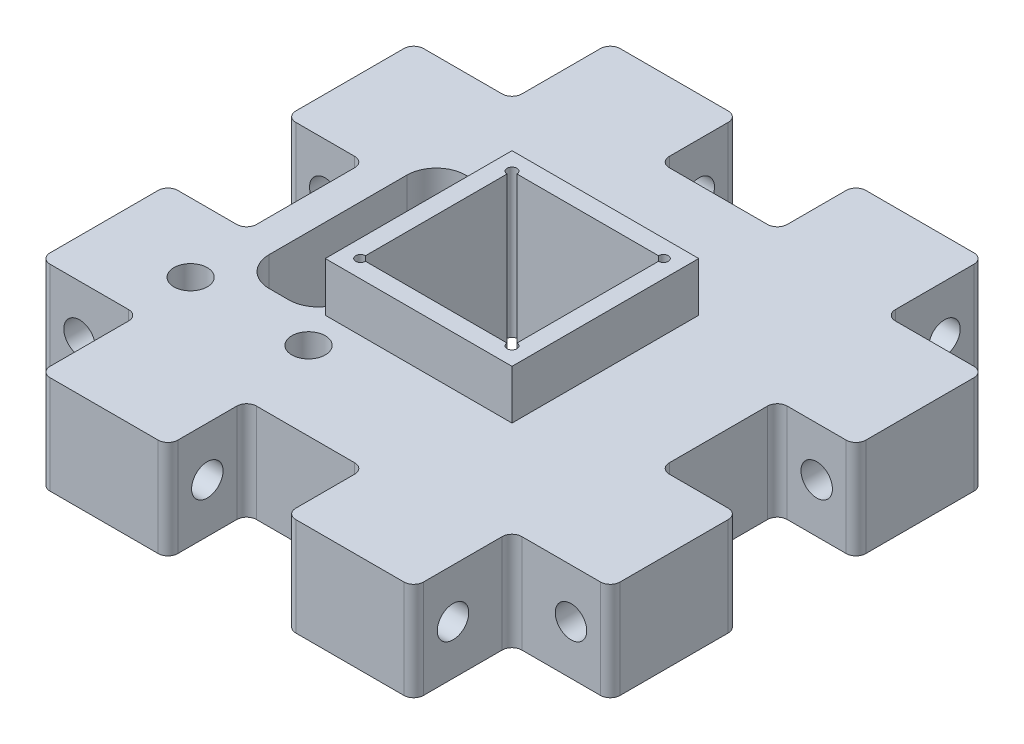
SolidWorks part; units mm, degrees
ref_plane "Front" through (0, 0, 0) normal (0, 0, 1) x (1, 0, 0)
ref_plane "Top" through (0, 0, 0) normal (0, 1, 0) x (1, 0, 0)
ref_plane "Right" through (0, 0, 0) normal (1, 0, 0) x (0, 0, -1)
sketch "草图1" plane through (0, 0, 0) normal (0, 1, 0) x (1, 0, 0)
  line L1 (-29, -29) -> (29, -29)
  line L2 (-29, -29) -> (-29, 29)
  line L3 (-29, 29) -> (29, 29)
  line L4 (29, -29) -> (29, 29)
  line L5 (-29, -29) -> (29, 29) construction
  line L6 (-29, 29) -> (29, -29) construction
  line L7 (-7.7, -7.7) -> (7.7, -7.7)
  line L8 (-7.7, -7.7) -> (-7.7, 7.7)
  line L9 (-7.7, 7.7) -> (7.7, 7.7)
  line L10 (7.7, -7.7) -> (7.7, 7.7)
  line L11 (-7.7, -7.7) -> (7.7, 7.7) construction
  line L12 (-7.7, 7.7) -> (7.7, -7.7) construction
  point P0 (0, 0)
  point P5 (0, 0)
  dimension "D1" = 58
  dimension "D2" = 58
  dimension "D3" = 15.4
  dimension "D4" = 15.4
extrude "凸台-拉伸1" add sketch "草图1" along normal blind 10
sketch "草图2" plane through (0, 10, 0) normal (0, 1, 0) x (1, 0, 0)
  line L0 (29, 6) -> (21, 6)
  line L1 (29, -29) -> (29, 29) construction
  line L2 (21, 6) -> (21, -6)
  line L3 (21, -6) -> (29, -6)
  line L5 (-6, 29) -> (-6, 21)
  line L6 (6, 21) -> (6, 29)
  line L7 (-6, 21) -> (6, 21)
  line L8 (-29, -6) -> (-21, -6)
  line L9 (-21, 6) -> (-29, 6)
  line L10 (-21, -6) -> (-21, 6)
  line L11 (6, -29) -> (6, -21)
  line L12 (-6, -21) -> (-6, -29)
  line L13 (6, -21) -> (-6, -21)
  point P23 (0, 0)
  dimension "D1" = 8
  dimension "D2" = 12
  dimension "D3" = 6
  dimension "D4" = 4
extrude "切除-拉伸1" cut sketch "草图2" against normal up to next contours L5 L7 L6 M14 | L2 L3 L0 M13 | L11 L13 L12 M16 | L8 L10 L9 M15
sketch "草图4" plane through (-29, 0, 0) normal (-1, 0, 0) x (0, 0, 1)
  line L0 (-29, 10) -> (-6, 10) construction
  line L1 (-29, 10) -> (-29, 0) construction
  circle A0 centre (-25, 5) radius 1.6
  dimension "D1" = 3.2
  dimension "D2" = 5
  dimension "D3" = 4
extrude "切除-拉伸2" cut sketch "草图4" against normal up to surface (58 mm away)
sketch "草图5" plane through (0, 0, -29) normal (0, 0, -1) x (-1, 0, 0)
  line L0 (6, 0) -> (29, 0) construction
  line L1 (29, 10) -> (29, 0) construction
  circle A0 centre (25, 5) radius 1.6
  dimension "D1" = 5
  dimension "D2" = 4
  dimension "D3" = 3.2
extrude "切除-拉伸3" cut sketch "草图5" against normal up to surface (58 mm away)
sketch "草图6" plane through (-29, 0, 0) normal (-1, 0, 0) x (0, 0, 1)
  line L0 (6, 0) -> (29, 0) construction
  line L1 (29, 10) -> (29, 0) construction
  circle A0 centre (25, 5) radius 1.6
  dimension "D1" = 5
  dimension "D2" = 4
  dimension "D3" = 3.2
extrude "切除-拉伸4" cut sketch "草图6" against normal up to surface (58 mm away)
sketch "草图7" plane through (0, 0, 29) normal (0, 0, 1) x (1, 0, 0)
  line L0 (6, 0) -> (29, 0) construction
  line L1 (29, 10) -> (29, 0) construction
  circle A0 centre (25, 5) radius 1.6
  dimension "D1" = 5
  dimension "D2" = 4
  dimension "D3" = 3.2
extrude "切除-拉伸5" cut sketch "草图7" against normal up to surface (58 mm away)
sketch "草图8" plane through (0, 0, 0) normal (0, -1, 0) x (1, 0, 0)
  line L0 (-7.7, -7.7) -> (-7.7, 7.7) construction
  line L1 (-17.7, 10) -> (-9.7, 10)
  line L2 (-9.7, 10) -> (-9.7, -10)
  line L3 (-9.7, -10) -> (-17.7, -10)
  line L4 (-17.7, 10) -> (-17.7, -10)
  dimension "D1" = 20
  dimension "D2" = 2
  dimension "D3" = 8
  dimension "D4" = 10
extrude "切除-拉伸6" cut sketch "草图8" against normal up to next
sketch "草图9" plane through (0, 0, 0) normal (0, -1, 0) x (-1, 0, 0)
  circle A0 centre (-7.7, -7.7) radius 0.5
  circle A1 centre (-7.7, 7.7) radius 0.5
  circle A2 centre (7.7, 7.7) radius 0.5
  circle A3 centre (7.7, -7.7) radius 0.5
  dimension "D1" = 1
  dimension "D2" = 1
  dimension "D3" = 1
  dimension "D4" = 1
extrude "切除-拉伸7" cut sketch "草图9" against normal up to next
sketch "草图10" plane through (0, 10, 0) normal (0, 1, 0) x (1, 0, 0)
  line L0 (7.2, 7.7) -> (-7.2, 7.7) construction
  line L1 (-7.7, 7.2) -> (-7.7, -7.2) construction
  line L2 (-7.2, -7.7) -> (7.2, -7.7) construction
  line L3 (7.7, -7.2) -> (7.7, 7.2) construction
  line L4 (7.2, 7.7) -> (-7.2, 7.7)
  line L5 (-7.7, 7.2) -> (-7.7, -7.2)
  line L6 (-7.2, -7.7) -> (7.2, -7.7)
  line L7 (7.7, -7.2) -> (7.7, 7.2)
  line L9 (9.5, 9.5) -> (-9.5, 9.5)
  line L10 (9.5, 9.5) -> (9.5, -9.5)
  line L11 (9.5, -9.5) -> (-9.5, -9.5)
  line L12 (-9.5, 9.5) -> (-9.5, -9.5)
  line L13 (9.5, 9.5) -> (-9.5, -9.5) construction
  line L14 (9.5, -9.5) -> (-9.5, 9.5) construction
  arc A0 (7.7, 7.2) -> (7.2, 7.7) centre (7.7, 7.7) ccw construction
  arc A1 (-7.2, 7.7) -> (-7.7, 7.2) centre (-7.7, 7.7) ccw construction
  arc A2 (-7.7, -7.2) -> (-7.2, -7.7) centre (-7.7, -7.7) ccw construction
  arc A3 (7.2, -7.7) -> (7.7, -7.2) centre (7.7, -7.7) ccw construction
  arc A4 (7.7, 7.2) -> (7.2, 7.7) centre (7.7, 7.7) ccw
  arc A5 (-7.2, 7.7) -> (-7.7, 7.2) centre (-7.7, 7.7) ccw
  arc A6 (-7.7, -7.2) -> (-7.2, -7.7) centre (-7.7, -7.7) ccw
  arc A7 (7.2, -7.7) -> (7.7, -7.2) centre (7.7, -7.7) ccw
  point P11 (0, 0)
  dimension "D1" = 19
  dimension "D2" = 19
extrude "凸台-拉伸2" add sketch "草图10" along normal blind 5
sketch "草图12" plane through (0, 0, 0) normal (0, -1, 0) x (1, 0, 0)
  line L1 (-29, 29) -> (-19, 29)
  line L2 (-29, 29) -> (-29, 19)
  line L3 (-29, 19) -> (-19, 19)
  line L4 (-19, 29) -> (-19, 19)
  line L5 (29, 29) -> (19, 29)
  line L6 (29, 29) -> (29, 19)
  line L7 (29, 19) -> (19, 19)
  line L8 (19, 29) -> (19, 19)
  line L9 (29, -29) -> (19, -29)
  line L10 (29, -29) -> (29, -19)
  line L11 (29, -19) -> (19, -19)
  line L12 (19, -29) -> (19, -19)
  line L13 (-29, -29) -> (-19, -29)
  line L14 (-29, -29) -> (-29, -19)
  line L15 (-29, -19) -> (-19, -19)
  line L16 (-19, -29) -> (-19, -19)
  dimension "D1" = 10
  dimension "D2" = 10
  dimension "D3" = 10
  dimension "D4" = 10
  dimension "D5" = 10
  dimension "D6" = 10
  dimension "D7" = 10
  dimension "D8" = 10
extrude "切除-拉伸8" cut sketch "草图12" against normal up to next
fillet "圆角2" radius 1 16 edges at (-29, 5, -6) (-29, 5, -19) (-19, 5, -29) (-6, 5, -29) (6, 5, -29) (19, 5, -29) (29, 5, -19) (29, 5, -6) (29, 5, 6) (29, 5, 19) (19, 5, 29) (6, 5, 29) (-6, 5, 29) (-29, 5, 6) (-29, 5, 19) (-19, 5, 29)
hole_wizard "Ø3.4 (3.4) 直径孔1" positions "草图13" profile "草图14" hole size "Ø3.4" standard "GB"
sketch "草图13" plane through (0, 10, 0) normal (0, 1, 0) x (1, 0, 0)
  line L0 (-17.7, 10) -> (-17.7, -10) construction
  line L1 (-9.7, -10) -> (-9.7, 10) construction
  line L2 (-17.7, -10) -> (-9.7, -10) construction
  point P0 (-19.7, -13)
  point P2 (-7.7, -13)
  dimension "D1" = 2
  dimension "D2" = 2
  dimension "D3" = 3
  dimension "D4" = 3
sketch "草图14" plane through (-19.7, 10, 13) normal (1, 0, 0) x (0, 0, 1)
  line L0 (0, 0) -> (0, 10)
  line L1 (0, 10) -> (1.7, 10)
  line L2 (1.7, 10) -> (1.7, 0)
  line L5 (1.7, 0) -> (0, 0)
  line L11 (0, -6.35) -> (0, 107.95) construction
  dimension "通孔孔直径" = 3.4
  dimension "通孔孔深度" = 10
fillet "圆角3" radius 3 4 edges at (-17.7, 5, 10) (-17.7, 5, -10) (-9.7, 5, -10) (-9.7, 5, 10)
fillet "圆角4" radius 1 12 edges at (-6, 5, -21) (6, 5, -21) (19, 5, -19) (21, 5, -6) (21, 5, 6) (19, 5, 19) (6, 5, 21) (-6, 5, 21) (-19, 5, 19) (-21, 5, 6) (-21, 5, -6) (-19, 5, -19)
sketch "草图15" plane through (0, 0, 0) normal (0, -1, 0) x (1, 0, 0)
  line L0 (-28, 19) -> (-20, 19) construction
  line L1 (-17.9679, 16) -> (-21.4321, 16)
  line L2 (-21.4321, 16) -> (-23.1641, 13)
  line L3 (-23.1641, 13) -> (-21.4321, 10)
  line L4 (-21.4321, 10) -> (-17.9679, 10)
  line L5 (-17.9679, 10) -> (-16.2359, 13)
  line L6 (-16.2359, 13) -> (-17.9679, 16)
  line L7 (-5.9679, 16) -> (-9.4321, 16)
  line L8 (-9.4321, 16) -> (-11.1641, 13)
  line L9 (-11.1641, 13) -> (-9.4321, 10)
  line L10 (-9.4321, 10) -> (-5.9679, 10)
  line L11 (-5.9679, 10) -> (-4.2359, 13)
  line L12 (-4.2359, 13) -> (-5.9679, 16)
  circle A0 centre (-19.7, 13) radius 3 construction
  circle A1 centre (-7.7, 13) radius 3 construction
  dimension "D2" = 6
  dimension "D1" = 6
extrude "切除-拉伸9" cut sketch "草图15" against normal blind 2.4
